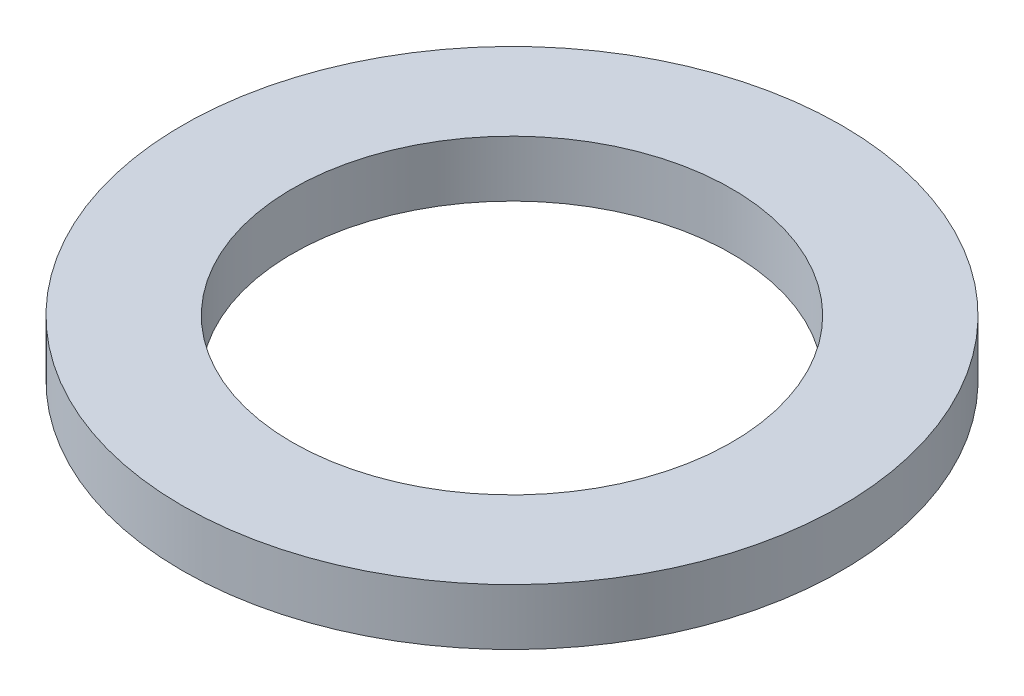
SolidWorks part; units mm, degrees
ref_plane "Front Plane" through (0, 0, 0) normal (0, 0, 1) x (1, 0, 0)
ref_plane "Top Plane" through (0, 0, 0) normal (0, 1, 0) x (1, 0, 0)
ref_plane "Right Plane" through (0, 0, 0) normal (1, 0, 0) x (0, 0, -1)
sketch "Sketch1" plane through (0, 0, 0) normal (0, 1, 0) x (1, 0, 0)
  circle A0 centre (0, 0) radius 2.3813
  dimension "OD" = 4.7625
extrude "Boss-Extrude1" add sketch "Sketch1" along normal blind 0.4064
sketch "Sketch5" plane through (0, 0.4064, 0) normal (0, 1, 0) x (-1, 0, 0)
  circle A0 centre (0, 0) radius 1.5875
  dimension "ID" = 3.175
extrude "Cut-Extrude1" cut sketch "Sketch5" against normal through all
